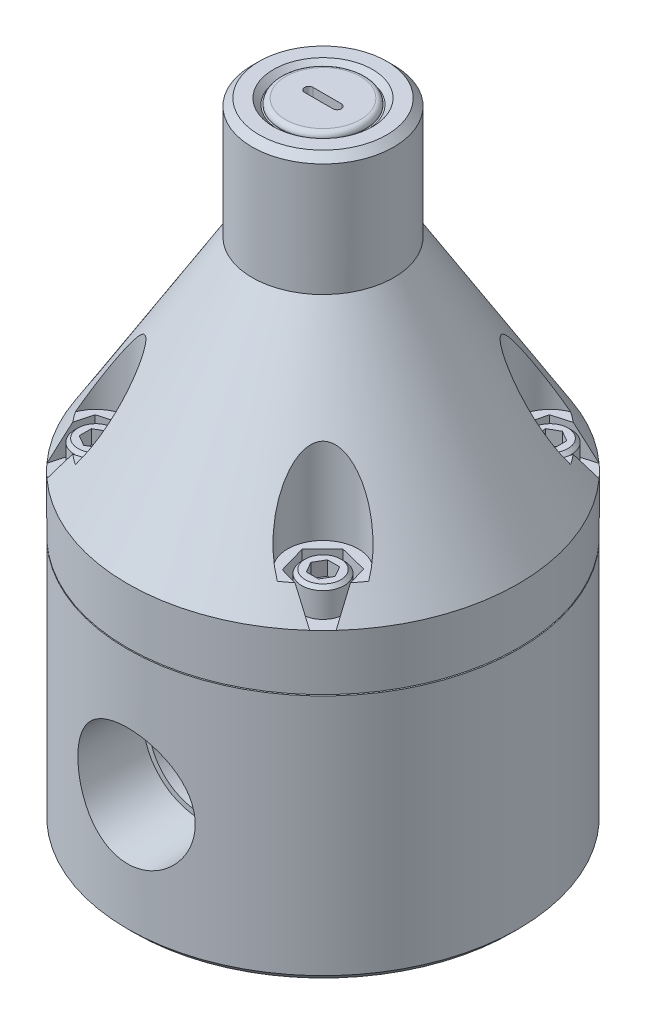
SolidWorks part; units mm, degrees
ref_plane "Front Plane" through (0, 0, 0) normal (0, 0, 1) x (1, 0, 0)
ref_plane "Top Plane" through (0, 0, 0) normal (0, 1, 0) x (1, 0, 0)
ref_plane "Right Plane" through (0, 0, 0) normal (1, 0, 0) x (0, 0, -1)
sketch "Sketch1" plane through (0, 0, 0) normal (0, 1, 0) x (1, 0, 0)
  circle A0 centre (0, 0) radius 43.815
  dimension "D1" = 87.63
extrude "Extrude1" add sketch "Sketch1" along normal blind 140.97
sketch "Sketch2" plane through (0, 0, 0) normal (0, 0, 1) x (1, 0, 0)
  line L0 (0, 0) -> (0, 140.97) construction
  line L1 (43.815, 140.97) -> (-43.815, 140.97) construction
  line L2 (-43.815, 56.134) -> (-43.815, 68.58)
  line L3 (-43.815, 56.134) -> (-30.226, 56.134)
  line L4 (-30.226, 56.134) -> (-30.226, 55.88)
  line L6 (-30.226, 55.88) -> (-49.4473, 55.88)
  line L7 (-49.4473, 55.88) -> (-49.4473, 147.034)
  line L8 (-49.4473, 147.034) -> (-15.875, 147.034)
  line L9 (-15.875, 147.034) -> (-15.875, 114.046)
  line L10 (-15.875, 114.046) -> (-43.815, 68.58)
  line L12 (-43.815, 0) -> (43.815, 0) construction
  dimension "D1" = 43.815
  dimension "D2" = 55.88
  dimension "D3" = 0.254
  dimension "D4" = 30.226
  dimension "D5" = 15.875
  dimension "D6" = 68.58
  dimension "D7" = 26.924
revolve "Cut-Revolve1" cut sketch "Sketch2" angle 360 about L0
ref_plane "Plane1" through (0, 140.97, 0) normal (0, 1, 0) x (-1, 0, 0)
sketch "Sketch3" plane through (0, 140.97, 0) normal (0, 1, 0) x (-1, 0, 0)
  circle A0 centre (0, 0) radius 11.1125
  dimension "D1" = 22.225
extrude "Extrude2" cut sketch "Sketch3" against normal blind 1.27 draft 45
chamfer "Chamfer1" distance 1.5748 angle 45 2 edges at (0, 0, 43.815) (0, 140.97, 15.875)
sketch "Sketch4" plane through (0, 140.97, 0) normal (0, 1, 0) x (-1, 0, 0)
  circle A0 centre (0, 0) radius 9.525
  dimension "D1" = 19.05
extrude "Extrude3" add sketch "Sketch4" against normal up to surface (1.27 mm away)
fillet "Fillet1" radius 1.143 1 edges at (0, 140.97, 9.525)
sketch "Sketch5" plane through (0, 140.97, 0) normal (0, 1, 0) x (-1, 0, 0)
  line L0 (-3.175, 0) -> (3.175, 0) construction
  line L1 (3.175, 0.9652) -> (-3.175, 0.9652)
  line L2 (-3.175, -0.9652) -> (3.175, -0.9652)
  arc A0 (-3.175, 0.9652) -> (-3.175, -0.9652) centre (-3.175, 0) ccw
  arc A1 (3.175, -0.9652) -> (3.175, 0.9652) centre (3.175, 0) ccw
  dimension "D1" = 3.175
  dimension "D2" = 6.35
  dimension "D3" = 0.9652
  dimension "D4" = 0.9652
extrude "Extrude4" cut sketch "Sketch5" against normal blind 3.302 draft 1
ref_plane "Plane2" through (0, 74.93, 0) normal (0, 1, 0) x (-1, 0, 0)
sketch "Sketch6" plane through (0, 74.93, 0) normal (0, 1, 0) x (-1, 0, 0)
  line L0 (0, 0) -> (-43.815, 0) construction
  line L1 (0, 0) -> (-30.9819, 30.9819) construction
  circle A0 centre (0, 0) radius 43.815 construction
  circle A1 centre (0, 0) radius 36.0045 construction
  circle A2 centre (-25.459, 25.459) radius 7.9375
  dimension "D1" = 72.009
  dimension "D2" = 15.875
extrude "Extrude5" cut sketch "Sketch6" along normal blind 22.86
sketch "Sketch8" plane through (0, 74.93, 0) normal (0, 1, 0) x (-1, 0, 0)
  line L0 (0, 0) -> (-30.9819, 30.9819) construction
  line L1 (-30.9819, 19.758) -> (-19.9362, 31.1601) construction
  line L2 (-30.9819, 30.9819) -> (-39.3973, 39.3973) construction
  line L3 (-29.9486, 20.8246) -> (-23.6903, 19.2537)
  line L4 (-23.6903, 19.2537) -> (-19.2007, 23.8882)
  line L5 (-19.2007, 23.8882) -> (-20.9694, 30.0935)
  line L9 (-29.9486, 20.8246) -> (-33.5917, 33.5917)
  line L10 (-33.5917, 33.5917) -> (-20.9694, 30.0935)
  line L12 (-27.2278, 31.6643) -> (-31.7174, 27.0299)
  line L13 (-20.9694, 30.0935) -> (-27.2278, 31.6643)
  line L14 (-31.7174, 27.0299) -> (-29.9486, 20.8246)
  circle A0 centre (0, 0) radius 43.815 construction
  arc A1 (-32.876, 22.6318) -> (-22.6318, 32.876) centre (-25.459, 25.459) ccw construction
  arc A2 (-32.876, 22.6318) -> (-22.6318, 32.876) centre (-25.459, 25.459) ccw construction
  circle A3 centre (-25.459, 25.459) radius 5.588 construction
extrude "Extrude6" cut sketch "Sketch8" against normal blind 6.35
pattern_circular "CirPattern1" count 4 over 360 about axis through (0, 0, 0) along (0, 1, 0) of "Extrude5", "Extrude6"
sketch "Sketch9" plane through (0, 74.93, 0) normal (0, 1, 0) x (-1, 0, 0)
  line L0 (0, 0) -> (-25.459, 25.459) construction
  circle A0 centre (-25.459, 25.459) radius 4.7625
  dimension "D1" = 9.525
extrude "Extrude7" add sketch "Sketch9" against normal up to surface (6.35 mm away)
sketch "Sketch10" plane through (0, 74.93, 0) normal (0, 1, 0) x (-1, 0, 0)
  line L1 (-28.1871, 25.459) -> (-26.8231, 23.0964)
  line L2 (-26.8231, 23.0964) -> (-24.095, 23.0964)
  line L3 (-24.095, 23.0964) -> (-22.7309, 25.459)
  line L4 (-22.7309, 25.459) -> (-24.095, 27.8216)
  line L5 (-24.095, 27.8216) -> (-26.8231, 27.8216)
  line L6 (-26.8231, 27.8216) -> (-28.1871, 25.459)
  circle A0 centre (-25.459, 25.459) radius 2.3626 construction
extrude "Extrude8" cut sketch "Sketch10" against normal blind 3.175
pattern_circular "CirPattern2" count 4 over 360 about axis through (0, 0, 0) along (0, 1, 0) of "Extrude7", "Extrude8"
chamfer "Chamfer2" distance 0.762 angle 45 4 edges at (-25.459, 74.93, -30.2215) (30.2215, 74.93, -25.459) (25.459, 74.93, 30.2215) (-30.2215, 74.93, 25.459)
ref_plane "Plane3" through (0, 0, 43.815) normal (0, 0, 1) x (1, 0, 0)
sketch "Sketch11" plane through (0, 0, 43.815) normal (0, 0, 1) x (1, 0, 0)
  line L0 (0, -6.7756) -> (0, 147.7456) construction
  line L1 (-48.3989, 25.4) -> (47.2148, 25.4) construction
  line L2 (-42.2402, 0) -> (42.2402, 0) construction
  dimension "D1" = 25.4
hole_wizard "3/4 Rc Tapped Hole2" positions "3DSketch3" profile "Sketch14" size "3/4" standard "BSI"
sketch3d "3DSketch3"
  line L0 (0, -6.7756, 43.815) -> (0, 147.7456, 43.815) construction
  point P0 (0, 27.432, 43.815)
sketch "Sketch14" plane through (0, 27.432, 43.815) normal (1, 0, 0) x (0, -1, 0)
  line L0 (0, 0) -> (0, 30.1635)
  line L1 (11.5, 25.4) -> (0, 30.1635)
  line L2 (-11.5, 25.4) -> (0, 30.1635) construction
  line L3 (11.5, 25.4) -> (11.5, 16.256)
  line L4 (11.5, 16.256) -> (12.7117, 16.256)
  line L5 (12.7117, 16.256) -> (13.2191, 0)
  line L6 (-12.7117, 16.256) -> (-13.2191, 0) construction
  line L7 (13.2191, 0) -> (0, 0)
  line L8 (0, -6.35) -> (0, 107.95) construction
  line L11 (-11.5, 16.256) -> (-12.7117, 16.256) construction
  dimension "Tap Drill Dia." = 23
  dimension "Tap Drill Depth" = 25.4
  dimension "Thread Dia." = 26.4383
  dimension "Thread Angle" = 3.576
  dimension "Thread Depth" = 16.256
  dimension "Drill Angle" = 135
mirror "Mirror1" about plane through (0, 0, 0) normal (0, 0, 1) of "3/4 Rc Tapped Hole2"
sketch "Sketch16" plane through (0, 0, 0) normal (0, 1, 0) x (1, 0, 0)
  line L0 (-42.2402, 0) -> (42.2402, 0) construction
  circle A0 centre (0, 0) radius 42.2402 construction
hole_wizard "3/4 Rc Tapped Hole3" positions "3DSketch5" profile "Sketch17" size "3/4" standard "BSI"
sketch3d "3DSketch5"
  point P0 (0, 0, 0)
  point P4 (0, 0, 0)
sketch "Sketch17" plane through (0, 0, 0) normal (1, 0, 0) x (0, 0, -1)
  line L0 (0, 0) -> (0, 28.2601)
  line L1 (4.76, 25.4) -> (0, 28.2601)
  line L2 (-4.76, 25.4) -> (0, 28.2601) construction
  line L3 (4.76, 25.4) -> (4.76, 16.256)
  line L4 (4.76, 16.256) -> (12.7117, 16.256)
  line L5 (12.7117, 16.256) -> (13.2191, 0)
  line L6 (-12.7117, 16.256) -> (-13.2191, 0) construction
  line L7 (13.2191, 0) -> (0, 0)
  line L8 (0, -6.35) -> (0, 107.95) construction
  line L11 (-4.76, 16.256) -> (-12.7117, 16.256) construction
  dimension "Tap Drill Dia." = 9.52
  dimension "Tap Drill Depth" = 25.4
  dimension "Thread Dia." = 26.4383
  dimension "Thread Angle" = 3.576
  dimension "Thread Depth" = 16.256
  dimension "Drill Angle" = 118
